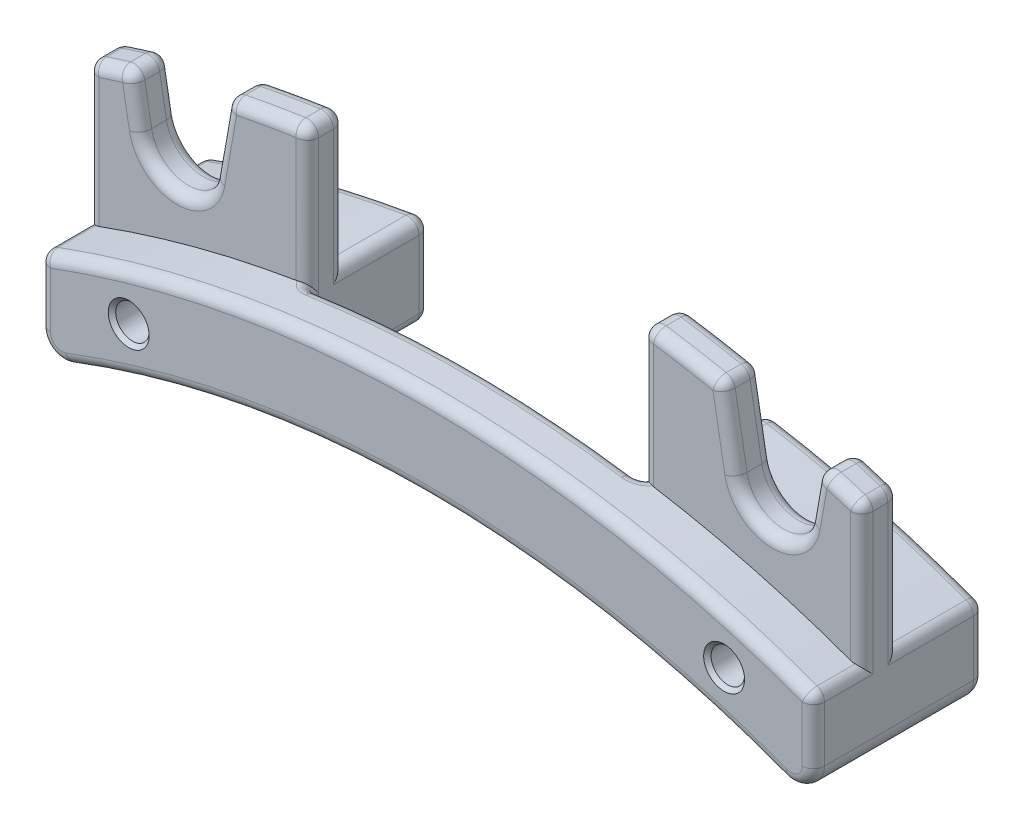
SolidWorks part; units mm, degrees
ref_plane "Спереди" through (0, 0, 0) normal (0, 0, 1) x (1, 0, 0)
ref_plane "Сверху" through (0, 0, 0) normal (0, 1, 0) x (1, 0, 0)
ref_plane "Справа" through (0, 0, 0) normal (1, 0, 0) x (0, 0, -1)
sketch "Эскиз1" plane through (0, 0, 0) normal (0, 0, 1) x (1, 0, 0)
  line L0 (0, 0) -> (0, 198.4501) construction
  line L1 (-52, 155.4005) -> (-52, 129.0078)
  line L2 (52, 155.4005) -> (52, 129.0078)
  line L3 (-22.5, 161.6278) -> (-22.5, 145.2679)
  line L4 (22.5, 161.6278) -> (22.5, 145.2679)
  line L5 (-40, 152.336) -> (-40, 159.975) construction
  line L6 (-45.8395, 156.6596) -> (-44.924, 151.4677)
  line L7 (-33.4842, 160.495) -> (-35.076, 151.4677)
  line L8 (33.4842, 160.495) -> (35.076, 151.4677)
  line L9 (45.8395, 156.6596) -> (44.924, 151.4677)
  line L10 (40, 152.336) -> (40, 159.975) construction
  arc A0 (47.9348, 126.2032) -> (-47.9348, 126.2032) centre (0, 0) ccw
  arc A1 (22.5, 145.2679) -> (-22.5, 145.2679) centre (0, 0) ccw
  arc A2 (50.9636, 156.827) -> (47.7511, 157.8349) centre (0, 0) ccw
  circle A3 centre (0, 0) radius 141 construction
  circle A4 centre (-40, 135.2072) radius 2.25
  circle A5 centre (40, 135.2072) radius 2.25
  arc A6 (-24.2203, 163.1116) -> (-32.3008, 161.7055) centre (0, 0) ccw
  arc A7 (-44.924, 151.4677) -> (-35.076, 151.4677) centre (-40, 152.336) ccw
  arc A8 (35.076, 151.4677) -> (44.924, 151.4677) centre (40, 152.336) ccw
  circle A9 centre (0, 0) radius 157.5 construction
  arc A10 (-47.7511, 157.8349) -> (-50.9636, 156.827) centre (0, 0) ccw
  arc A11 (32.3008, 161.7055) -> (24.2203, 163.1116) centre (0, 0) ccw
  arc A12 (47.9348, 126.2032) -> (52, 129.0078) centre (49, 129.0078) ccw
  arc A13 (-47.9348, 126.2032) -> (-52, 129.0078) centre (-49, 129.0078) cw
  arc A14 (50.9636, 156.827) -> (52, 155.4005) centre (50.5, 155.4005) cw
  arc A15 (47.7511, 157.8349) -> (45.8395, 156.6596) centre (47.3167, 156.3991) ccw
  arc A16 (33.4842, 160.495) -> (32.3008, 161.7055) centre (32.007, 160.2346) ccw
  arc A17 (22.5, 161.6278) -> (24.2203, 163.1116) centre (24, 161.6278) cw
  arc A18 (-22.5, 161.6278) -> (-24.2203, 163.1116) centre (-24, 161.6278) ccw
  arc A19 (-33.4842, 160.495) -> (-32.3008, 161.7055) centre (-32.007, 160.2346) cw
  arc A20 (-45.8395, 156.6596) -> (-47.7511, 157.8349) centre (-47.3167, 156.3991) ccw
  arc A21 (-50.9636, 156.827) -> (-52, 155.4005) centre (-50.5, 155.4005) ccw
  point P39 (33.3068, 161.5013)
  point P42 (22.5, 163.3578)
  point P45 (-22.5, 163.3578)
  point P50 (-46.1315, 158.3158)
  dimension "D1" = 294
  dimension "D2" = 270
  dimension "D4" = 329.8
  dimension "D5" = 282
  dimension "D6" = 4.5
  dimension "D10" = 10
  dimension "D11" = 315
  dimension "D16" = 3
  dimension "D17" = 1.5
  dimension "D3" = 104
  dimension "D7" = 80
  dimension "D8" = 29.5
  dimension "D9" = 52
  dimension "D12" = 20
  dimension "D13" = 10
  dimension "D14" = 20
  dimension "D15" = 10
extrude "Бобышка-Вытянуть1" add sketch "Эскиз1" along normal blind 5
sketch "Эскиз2" plane through (0, 0, 5) normal (0, 0, 1) x (1, 0, 0)
  line L8 (52, 129.0078) -> (52, 155.4005)
  line L9 (45.8395, 156.6596) -> (44.924, 151.4677)
  line L10 (35.076, 151.4677) -> (33.4842, 160.495)
  line L11 (22.5, 161.6278) -> (22.5, 145.2679)
  line L12 (-22.5, 145.2679) -> (-22.5, 161.6278)
  line L13 (-33.4842, 160.495) -> (-35.076, 151.4677)
  line L14 (-44.924, 151.4677) -> (-45.8395, 156.6596)
  line L15 (-52, 155.4005) -> (-52, 129.0078)
  line L16 (52, 129.0078) -> (52, 137.4955)
  line L23 (-52, 137.4955) -> (-52, 129.0078)
  circle A0 centre (-40, 135.2072) radius 2.25 construction
  circle A1 centre (40, 135.2072) radius 2.25 construction
  circle A2 centre (-40, 135.2072) radius 2.25
  circle A3 centre (40, 135.2072) radius 2.25
  arc A18 (47.9348, 126.2032) -> (52, 129.0078) centre (49, 129.0078) ccw
  arc A19 (52, 155.4005) -> (50.9636, 156.827) centre (50.5, 155.4005) ccw
  arc A20 (50.9636, 156.827) -> (47.7511, 157.8349) centre (0, 0) ccw
  arc A21 (47.7511, 157.8349) -> (45.8395, 156.6596) centre (47.3167, 156.3991) ccw
  arc A22 (35.076, 151.4677) -> (44.924, 151.4677) centre (40, 152.336) ccw
  arc A23 (33.4842, 160.495) -> (32.3008, 161.7055) centre (32.007, 160.2346) ccw
  arc A24 (32.3008, 161.7055) -> (24.2203, 163.1116) centre (0, 0) ccw
  arc A25 (24.2203, 163.1116) -> (22.5, 161.6278) centre (24, 161.6278) ccw
  arc A26 (22.5, 145.2679) -> (-22.5, 145.2679) centre (0, 0) ccw
  arc A27 (-22.5, 161.6278) -> (-24.2203, 163.1116) centre (-24, 161.6278) ccw
  arc A28 (-24.2203, 163.1116) -> (-32.3008, 161.7055) centre (0, 0) ccw
  arc A29 (-32.3008, 161.7055) -> (-33.4842, 160.495) centre (-32.007, 160.2346) ccw
  arc A30 (-44.924, 151.4677) -> (-35.076, 151.4677) centre (-40, 152.336) ccw
  arc A31 (-45.8395, 156.6596) -> (-47.7511, 157.8349) centre (-47.3167, 156.3991) ccw
  arc A32 (-47.7511, 157.8349) -> (-50.9636, 156.827) centre (0, 0) ccw
  arc A33 (-50.9636, 156.827) -> (-52, 155.4005) centre (-50.5, 155.4005) ccw
  arc A34 (-52, 129.0078) -> (-47.9348, 126.2032) centre (-49, 129.0078) ccw
  arc A35 (47.9348, 126.2032) -> (-47.9348, 126.2032) centre (0, 0) ccw
  arc A36 (47.9348, 126.2032) -> (52, 129.0078) centre (49, 129.0078) ccw
  arc A44 (52, 137.4955) -> (-52, 137.4955) centre (0, 0) ccw
  arc A52 (-52, 129.0078) -> (-47.9348, 126.2032) centre (-49, 129.0078) ccw
  arc A53 (47.9348, 126.2032) -> (-47.9348, 126.2032) centre (0, 0) ccw
  dimension "D1" = 0
extrude "Бобышка-Вытянуть2" add sketch "Эскиз2" along normal blind 6.5
sketch "Эскиз3" plane through (0, 0, 0) normal (0, 0, -1) x (-1, 0, 0)
  line L0 (-22.5, 161.6278) -> (-22.5, 145.2679) construction
  line L1 (-22.5, 145.2679) -> (-22.5, 133.1118)
  line L2 (22.5, 145.2679) -> (22.5, 161.6278) construction
  line L3 (22.5, 133.1118) -> (22.5, 145.2679)
  line L8 (52, 129.0078) -> (52, 155.4005)
  line L9 (45.8395, 156.6596) -> (44.924, 151.4677)
  line L10 (35.076, 151.4677) -> (33.4842, 160.495)
  line L11 (22.5, 161.6278) -> (22.5, 145.2679)
  line L12 (-22.5, 145.2679) -> (-22.5, 161.6278)
  line L13 (-33.4842, 160.495) -> (-35.076, 151.4677)
  line L14 (-44.924, 151.4677) -> (-45.8395, 156.6596)
  line L15 (-52, 155.4005) -> (-52, 129.0078)
  line L16 (52, 129.0078) -> (52, 137.4955)
  line L23 (-52, 137.4955) -> (-52, 129.0078)
  circle A0 centre (-40, 135.2072) radius 2.25 construction
  circle A1 centre (40, 135.2072) radius 2.25 construction
  circle A2 centre (-40, 135.2072) radius 2.25
  circle A3 centre (40, 135.2072) radius 2.25
  arc A4 (47.9348, 126.2032) -> (-47.9348, 126.2032) centre (0, 0) ccw construction
  arc A5 (22.5, 145.2679) -> (-22.5, 145.2679) centre (0, 0) ccw construction
  arc A6 (52, 137.4955) -> (22.5, 145.2679) centre (0, 0) ccw
  arc A7 (47.9348, 126.2032) -> (22.5, 133.1118) centre (0, 0) ccw
  arc A8 (-22.5, 145.2679) -> (-52, 137.4955) centre (0, 0) ccw
  arc A9 (-22.5, 133.1118) -> (-47.9348, 126.2032) centre (0, 0) ccw
  arc A18 (-52, 129.0078) -> (-47.9348, 126.2032) centre (-49, 129.0078) ccw
  arc A19 (47.9348, 126.2032) -> (-47.9348, 126.2032) centre (0, 0) ccw
  arc A20 (47.9348, 126.2032) -> (52, 129.0078) centre (49, 129.0078) ccw
  arc A21 (52, 155.4005) -> (50.9636, 156.827) centre (50.5, 155.4005) ccw
  arc A22 (50.9636, 156.827) -> (47.7511, 157.8349) centre (0, 0) ccw
  arc A23 (47.7511, 157.8349) -> (45.8395, 156.6596) centre (47.3167, 156.3991) ccw
  arc A24 (35.076, 151.4677) -> (44.924, 151.4677) centre (40, 152.336) ccw
  arc A25 (33.4842, 160.495) -> (32.3008, 161.7055) centre (32.007, 160.2346) ccw
  arc A26 (32.3008, 161.7055) -> (24.2203, 163.1116) centre (0, 0) ccw
  arc A27 (24.2203, 163.1116) -> (22.5, 161.6278) centre (24, 161.6278) ccw
  arc A28 (22.5, 145.2679) -> (-22.5, 145.2679) centre (0, 0) ccw
  arc A29 (-22.5, 161.6278) -> (-24.2203, 163.1116) centre (-24, 161.6278) ccw
  arc A30 (-24.2203, 163.1116) -> (-32.3008, 161.7055) centre (0, 0) ccw
  arc A31 (-32.3008, 161.7055) -> (-33.4842, 160.495) centre (-32.007, 160.2346) ccw
  arc A32 (-44.924, 151.4677) -> (-35.076, 151.4677) centre (-40, 152.336) ccw
  arc A33 (-45.8395, 156.6596) -> (-47.7511, 157.8349) centre (-47.3167, 156.3991) ccw
  arc A34 (-47.7511, 157.8349) -> (-50.9636, 156.827) centre (0, 0) ccw
  arc A35 (-50.9636, 156.827) -> (-52, 155.4005) centre (-50.5, 155.4005) ccw
  arc A36 (-52, 129.0078) -> (-47.9348, 126.2032) centre (-49, 129.0078) ccw
  arc A38 (47.9348, 126.2032) -> (52, 129.0078) centre (49, 129.0078) ccw
  dimension "D1" = 0
extrude "Бобышка-Вытянуть3" add sketch "Эскиз3" along normal blind 11.5
sketch "Эскиз4" plane through (0, 0, 0) normal (0, 0, 1) x (1, 0, 0)
  line L2 (-22.5, 145.2679) -> (-22.5, 133.1118)
  line L3 (22.5, 133.1118) -> (22.5, 145.2679)
  line L4 (-22.5, 145.2679) -> (-22.5, 133.1118)
  line L5 (22.5, 133.1118) -> (22.5, 145.2679)
  arc A2 (22.5, 145.2679) -> (-22.5, 145.2679) centre (0, 0) ccw
  arc A3 (22.5, 133.1118) -> (-22.5, 133.1118) centre (0, 0) ccw
  arc A4 (22.5, 145.2679) -> (-22.5, 145.2679) centre (0, 0) ccw
  arc A5 (22.5, 133.1118) -> (-22.5, 133.1118) centre (0, 0) ccw
  dimension "D1" = 0
extrude "Вырез-Вытянуть2" cut sketch "Эскиз4" along normal blind 5
fillet "Скругление1" radius 1.5 66 edges at (-23.0203, 162.7637, 5) (23.0203, 162.7637, 5) (-28.2693, 162.4588, 5) (28.2693, 162.4588, 5) (-33.0796, 161.2831, 5) (33.0796, 161.2831, 5) (-34.2801, 155.9814, 5) (34.2801, 155.9814, 5) (-40, 147.336, 5) (40, 147.336, 5) (-45.3818, 154.0637, 5) (45.3818, 154.0637, 5) (-46.5311, 157.6769, 5) (46.5311, 157.6769, 5) (-49.3599, 157.3392, 5) (49.3599, 157.3392, 5) (-51.7135, 156.2821, 5) (51.7135, 156.2821, 5) (-50.7036, 126.5384, -11.5) (-50.7036, 126.5384, 11.5) (-52, 146.448, 0) (-52, 133.2516, -11.5) (-52, 133.2516, 11.5) (50.7036, 126.5384, -11.5) (52, 133.2516, -11.5) (52, 133.2516, 11.5) (50.7036, 126.5384, 11.5) (0, 147, 11.5) (0, 135, 11.5) (35.3864, 130.2797, -11.5) (-35.3864, 130.2797, -11.5) (22.5, 153.4479, 0) (23.0203, 162.7637, 0) (28.2693, 162.4588, 0) (33.0796, 161.2831, 0) (34.2801, 155.9814, 0) (40, 147.336, 0) (45.3818, 154.0637, 0) (46.5311, 157.6769, 0) (49.3599, 157.3392, 0) (51.7135, 156.2821, 0) (-51.7135, 156.2821, 0) (-49.3599, 157.3392, 0) (-46.5311, 157.6769, 0) (-45.3818, 154.0637, 0) (-40, 147.336, 0) (-34.2801, 155.9814, 0) (-33.0796, 161.2831, 0) (-28.2693, 162.4588, 0) (-23.0203, 162.7637, 0) (-37.4522, 142.149, -11.5) (-22.5, 153.4479, 0) (22.5, 145.2679, -5.75) (-22.5, 145.2679, -5.75) (-52, 137.4955, -5.75) (22.5, 139.1898, -11.5) (37.4522, 142.149, -11.5) (-22.5, 139.1898, -11.5)
fillet "Скругление2" radius 1.5 7 edges at (-22.7153, 133.2936, -10.7743) (22.7153, 133.2936, -10.7743) (-22.5, 133.1118, -2.5) (0, 135, 5)
fillet "Скругление3" radius 1.5 3 edges at (22.1778, 145.3174, 4.4289) (-21.9448, 145.3528, 4.6651)
chamfer "Фаска1" distance 0.5 angle 45 4 edges at (37.75, 135.2072, -11.5) (42.25, 135.2072, 11.5) (-37.75, 135.2072, 11.5) (-42.25, 135.2072, -11.5)
